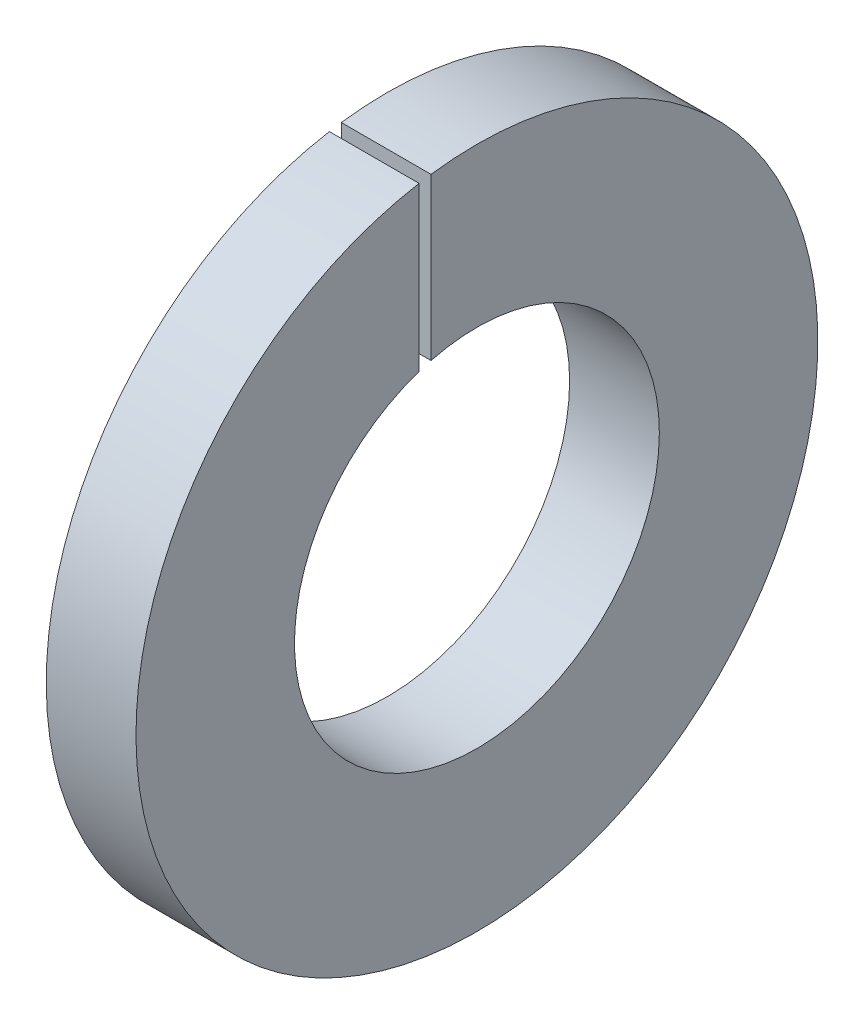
SolidWorks part; units mm, degrees
ref_plane "Plan de face" through (0, 0, 0) normal (0, 0, 1) x (1, 0, 0)
ref_plane "Plan de dessus" through (0, 0, 0) normal (0, 1, 0) x (1, 0, 0)
ref_plane "Plan de droite" through (0, 0, 0) normal (1, 0, 0) x (0, 0, -1)
sketch "Esquisse1" plane through (0, 0, 0) normal (0, 0, 1) x (1, 0, 0)
  line L0 (-42.8553, 0) -> (40.7584, 0) construction
  line L2 (0, 3.05) -> (1.5, 3.05)
  line L3 (0, 3.05) -> (0, 5.7)
  line L4 (0, 5.7) -> (1.5, 5.7)
  line L5 (1.5, 3.05) -> (1.5, 5.7)
  dimension "D1" = 6.1
  dimension "D2" = 11.4
  dimension "D3" = 1.5
revolve "Révolution1" add sketch "Esquisse1" angle 360 about L0
sketch "Esquisse2" plane through (1.5, 0, 0) normal (1, 0, 0) x (0, 0, -1)
  line L0 (-0.767, 5.6482) -> (-0.767, 2.952)
  line L1 (-0.967, 5.6174) -> (-0.967, 2.8926)
  circle A0 centre (0, 0) radius 5.7 construction
  circle A1 centre (0, 0) radius 3.05 construction
  arc A2 (-0.767, 2.952) -> (-0.967, 2.8926) centre (0, 0) ccw
  arc A3 (-0.767, 5.6482) -> (-0.967, 5.6174) centre (0, 0) ccw
  dimension "D1" = 0.2
extrude "Enlèv. mat.-Extru.1" cut sketch "Esquisse2" against normal through all
